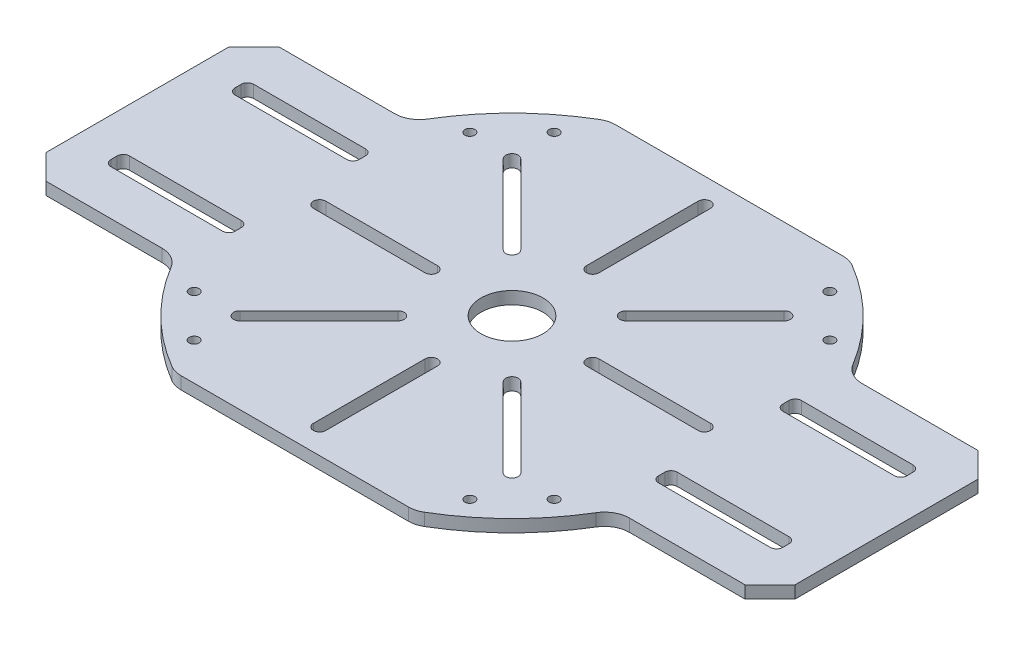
SolidWorks part; units mm, degrees
ref_plane "Front Plane" through (0, 0, 0) normal (0, 0, 1) x (1, 0, 0)
ref_plane "Top Plane" through (0, 0, 0) normal (0, 1, 0) x (1, 0, 0)
ref_plane "Right Plane" through (0, 0, 0) normal (1, 0, 0) x (0, 0, -1)
sketch "Sketch1" plane through (0, 0, 0) normal (0, 1, 0) x (1, 0, 0)
  line L0 (0, -1000) -> (0, 49000) construction
  line L1 (-23.2448, 44.45) -> (23.2448, 44.45)
  line L2 (-76.5969, 18.7325) -> (-76.5969, -18.7325)
  line L3 (-23.2448, -44.45) -> (23.2448, -44.45)
  line L4 (76.5969, 18.7325) -> (76.5969, -18.7325)
  line L6 (35.4178, 36.4243) -> (41.9684, 29.8736) construction
  line L7 (-76.5969, 0) -> (76.5969, 0) construction
  line L8 (-71.5169, 23.8125) -> (-47.8309, 23.8125)
  line L9 (-71.5169, -23.8125) -> (-47.8309, -23.8125)
  line L10 (-23.8125, 64.7529) -> (-23.8125, -44.45) construction
  line L11 (23.8125, 64.7529) -> (23.8125, -44.45) construction
  line L12 (47.8309, -23.8125) -> (71.5169, -23.8125)
  line L13 (47.8309, 23.8125) -> (71.5169, 23.8125)
  line L14 (-76.5969, -18.7325) -> (-71.5169, -23.8125)
  line L15 (-71.5169, 23.8125) -> (-76.5969, 18.7325)
  line L16 (71.5169, 23.8125) -> (76.5969, 18.7325)
  line L17 (71.5169, -23.8125) -> (76.5969, -18.7325)
  line L18 (707.1068, -707.1068) -> (-34648.2323, 34648.2323) construction
  line L19 (-707.1068, -707.1068) -> (34648.2323, 34648.2323) construction
  circle A0 centre (0, 0) radius 6.35
  arc A1 (-25.8276, 43.7444) -> (-43.4827, 26.2659) centre (0, 0) ccw
  arc A2 (25.8276, 43.7444) -> (23.2448, 44.45) centre (23.2448, 39.37) ccw
  arc A3 (-23.2448, 44.45) -> (-25.8276, 43.7444) centre (-23.2448, 39.37) ccw
  arc A4 (25.8276, -43.7444) -> (43.4827, -26.2659) centre (0, 0) ccw
  arc A5 (25.8276, -43.7444) -> (23.2448, -44.45) centre (23.2448, -39.37) cw
  arc A6 (-25.8276, -43.7444) -> (-23.2448, -44.45) centre (-23.2448, -39.37) ccw
  arc A7 (-43.4827, -26.2659) -> (-25.8276, -43.7444) centre (0, 0) ccw
  arc A8 (43.4827, 26.2659) -> (25.8276, 43.7444) centre (0, 0) ccw
  arc A9 (-47.8309, -23.8125) -> (-43.4827, -26.2659) centre (-47.8309, -28.8925) cw
  arc A10 (47.8309, -23.8125) -> (43.4827, -26.2659) centre (47.8309, -28.8925) ccw
  arc A11 (43.4827, 26.2659) -> (47.8309, 23.8125) centre (47.8309, 28.8925) ccw
  arc A12 (-47.8309, 23.8125) -> (-43.4827, 26.2659) centre (-47.8309, 28.8925) ccw
  circle A13 centre (36.8191, 28.198) radius 1.016
  circle A14 centre (28.198, 36.8191) radius 1.016
  circle A15 centre (26.6716, 26.6716) radius 0.081
  circle A16 centre (26.6716, -26.6716) radius 0.081
  circle A17 centre (36.8191, -28.198) radius 1.016
  circle A18 centre (28.198, -36.8191) radius 1.016
  circle A19 centre (-26.6716, -26.6716) radius 0.081
  circle A20 centre (-28.198, -36.8191) radius 1.016
  circle A21 centre (-36.8191, -28.198) radius 1.016
  circle A22 centre (-26.6716, 26.6716) radius 0.081
  circle A23 centre (-36.8191, 28.198) radius 1.016
  circle A24 centre (-28.198, 36.8191) radius 1.016
  point P0 (0, 0)
  point P8 (76.5969, -23.8125)
  point P11 (-76.5969, -23.8125)
  point P12 (-76.5969, 23.8125)
  point P34 (76.5969, 23.8125)
  point P81 (0, 0)
  dimension "D3" = 12.7
  dimension "D6" = 5.08
  dimension "D1" = 5.08
  dimension "D2" = 5.08
  dimension "D7" = 4.826
  dimension "D4" = 23.8125
  dimension "D5" = 23.8125
  dimension "D8" = 6.096
  dimension "D13" = 4
extrude "Boss-Extrude1" add sketch "Sketch1" along normal blind 2.54
sketch "Sketch3" plane through (0, 2.54, 0) normal (0, 1, 0) x (1, 0, 0)
  line L0 (0, 0) -> (46.2784, 46.2784) construction
  line L1 (10.7763, 12.5724) -> (26.9408, 28.7368)
  line L2 (16.51, -1.27) -> (39.37, -1.27)
  line L3 (16.51, 1.27) -> (39.37, 1.27)
  line L4 (12.5724, 10.7763) -> (28.7368, 26.9408)
  line L5 (10.5167, 12.1967) -> (28.9964, 27.3164) construction
  line L6 (19.7566, 19.7566) -> (12.1967, 10.5167) construction
  line L7 (35.921, 35.921) -> (38.568, 33.274) construction
  line L8 (10.7763, -12.5724) -> (26.9408, -28.7368)
  line L9 (12.5724, -10.7763) -> (28.7368, -26.9408)
  line L10 (-1.27, -16.51) -> (-1.27, -39.37)
  line L11 (1.27, -16.51) -> (1.27, -39.37)
  line L12 (-12.5724, -10.7763) -> (-28.7368, -26.9408)
  line L13 (-10.7763, -12.5724) -> (-26.9408, -28.7368)
  line L14 (-16.51, 1.27) -> (-39.37, 1.27)
  line L15 (-16.51, -1.27) -> (-39.37, -1.27)
  line L16 (-10.7763, 12.5724) -> (-26.9408, 28.7368)
  line L17 (-12.5724, 10.7763) -> (-28.7368, 26.9408)
  line L18 (1.27, 16.51) -> (1.27, 39.37)
  line L19 (-1.27, 16.51) -> (-1.27, 39.37)
  arc A0 (43.4827, 26.2659) -> (25.8276, 43.7444) centre (0, 0) ccw construction
  arc A1 (28.7368, 26.9408) -> (26.9408, 28.7368) centre (27.8388, 27.8388) ccw
  arc A2 (10.7763, 12.5724) -> (12.5724, 10.7763) centre (11.6743, 11.6743) ccw
  arc A3 (39.37, -1.27) -> (39.37, 1.27) centre (39.37, 0) ccw
  arc A4 (16.51, 1.27) -> (16.51, -1.27) centre (16.51, 0) ccw
  arc A5 (26.9408, -28.7368) -> (28.7368, -26.9408) centre (27.8388, -27.8388) ccw
  arc A6 (12.5724, -10.7763) -> (10.7763, -12.5724) centre (11.6743, -11.6743) ccw
  arc A7 (-1.27, -39.37) -> (1.27, -39.37) centre (0, -39.37) ccw
  arc A8 (1.27, -16.51) -> (-1.27, -16.51) centre (0, -16.51) ccw
  arc A9 (-28.7368, -26.9408) -> (-26.9408, -28.7368) centre (-27.8388, -27.8388) ccw
  arc A10 (-10.7763, -12.5724) -> (-12.5724, -10.7763) centre (-11.6743, -11.6743) ccw
  arc A11 (-39.37, 1.27) -> (-39.37, -1.27) centre (-39.37, 0) ccw
  arc A12 (-16.51, -1.27) -> (-16.51, 1.27) centre (-16.51, 0) ccw
  arc A13 (-26.9408, 28.7368) -> (-28.7368, 26.9408) centre (-27.8388, 27.8388) ccw
  arc A14 (-12.5724, 10.7763) -> (-10.7763, 12.5724) centre (-11.6743, 11.6743) ccw
  arc A15 (1.27, 39.37) -> (-1.27, 39.37) centre (0, 39.37) ccw
  arc A16 (-1.27, 16.51) -> (1.27, 16.51) centre (0, 16.51) ccw
  point P4 (19.7566, 19.7566)
  point P64 (0, 0)
  dimension "D1" = 8
  dimension "D3" = 1.27
extrude "Cut-Extrude1" cut sketch "Sketch3" against normal blind 2.54
sketch "Sketch4" plane through (0, 2.54, 0) normal (0, 1, 0) x (1, 0, 0)
  line L0 (-1000, 0) -> (49000, 0) construction
  line L1 (76.5969, -18.7325) -> (76.5969, 18.7325) construction
  line L2 (44.5929, 14.605) -> (67.4529, 14.605)
  line L3 (43.3229, 13.335) -> (43.3229, 12.065)
  line L4 (44.5929, 10.795) -> (67.4529, 10.795)
  line L5 (68.7229, 13.335) -> (68.7229, 12.065)
  line L6 (43.3229, 14.605) -> (68.7229, 10.795) construction
  line L7 (43.3229, 10.795) -> (68.7229, 14.605) construction
  line L8 (68.7229, -13.335) -> (68.7229, -12.065)
  line L9 (44.5929, -10.795) -> (67.4529, -10.795)
  line L10 (43.3229, -13.335) -> (43.3229, -12.065)
  line L11 (44.5929, -14.605) -> (67.4529, -14.605)
  line L12 (0, 0) -> (0, -50000) construction
  line L13 (-44.5929, -14.605) -> (-67.4529, -14.605)
  line L14 (-43.3229, -13.335) -> (-43.3229, -12.065)
  line L15 (-44.5929, -10.795) -> (-67.4529, -10.795)
  line L16 (-68.7229, -13.335) -> (-68.7229, -12.065)
  line L17 (-43.3229, 10.795) -> (-68.7229, 14.605) construction
  line L18 (-43.3229, 14.605) -> (-68.7229, 10.795) construction
  line L19 (-68.7229, 13.335) -> (-68.7229, 12.065)
  line L20 (-44.5929, 10.795) -> (-67.4529, 10.795)
  line L21 (-43.3229, 13.335) -> (-43.3229, 12.065)
  line L22 (-44.5929, 14.605) -> (-67.4529, 14.605)
  arc A0 (44.5929, 10.795) -> (43.3229, 12.065) centre (44.5929, 12.065) cw
  arc A1 (43.3229, 13.335) -> (44.5929, 14.605) centre (44.5929, 13.335) cw
  arc A2 (68.7229, 12.065) -> (67.4529, 10.795) centre (67.4529, 12.065) cw
  arc A3 (68.7229, 13.335) -> (67.4529, 14.605) centre (67.4529, 13.335) ccw
  arc A4 (68.7229, -12.065) -> (67.4529, -10.795) centre (67.4529, -12.065) ccw
  arc A5 (68.7229, -13.335) -> (67.4529, -14.605) centre (67.4529, -13.335) cw
  arc A6 (44.5929, -10.795) -> (43.3229, -12.065) centre (44.5929, -12.065) ccw
  arc A7 (43.3229, -13.335) -> (44.5929, -14.605) centre (44.5929, -13.335) ccw
  arc A8 (-43.3229, -13.335) -> (-44.5929, -14.605) centre (-44.5929, -13.335) cw
  arc A9 (-44.5929, -10.795) -> (-43.3229, -12.065) centre (-44.5929, -12.065) cw
  arc A10 (-68.7229, -13.335) -> (-67.4529, -14.605) centre (-67.4529, -13.335) ccw
  arc A11 (-68.7229, -12.065) -> (-67.4529, -10.795) centre (-67.4529, -12.065) cw
  arc A12 (-68.7229, 13.335) -> (-67.4529, 14.605) centre (-67.4529, 13.335) cw
  arc A13 (-68.7229, 12.065) -> (-67.4529, 10.795) centre (-67.4529, 12.065) ccw
  arc A14 (-43.3229, 13.335) -> (-44.5929, 14.605) centre (-44.5929, 13.335) ccw
  arc A15 (-44.5929, 10.795) -> (-43.3229, 12.065) centre (-44.5929, 12.065) ccw
  point P1 (56.0229, 12.7)
  point P64 (-56.0229, 12.7)
  dimension "D5" = 1.27
  dimension "D1" = 25.4
  dimension "D2" = 3.81
  dimension "D3" = 7.874
  dimension "D4" = 10.795
extrude "Cut-Extrude2" cut sketch "Sketch4" against normal blind 2.54
